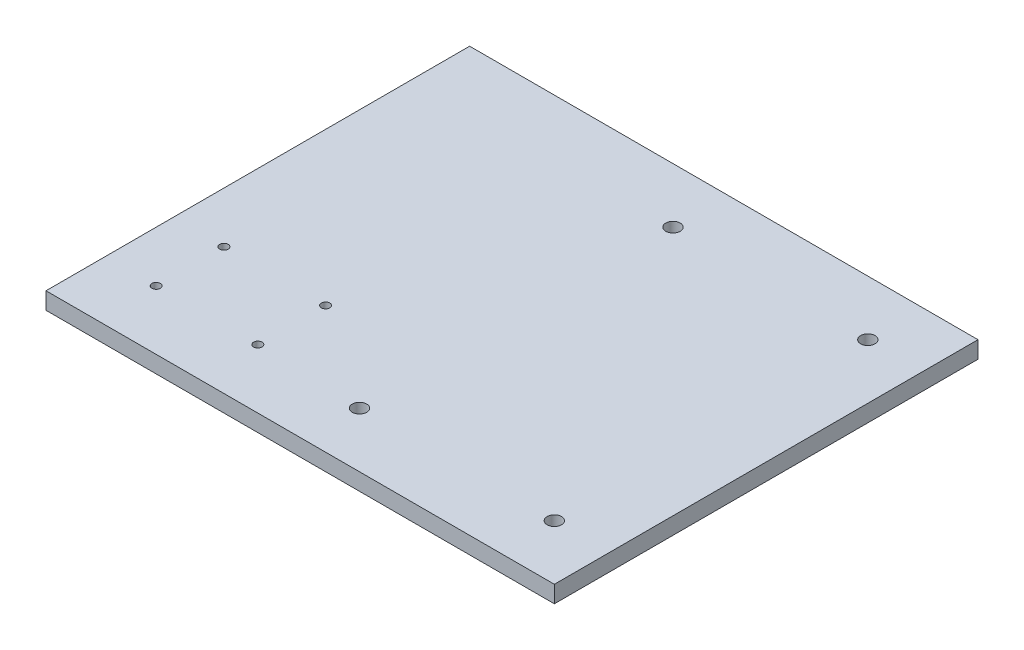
SolidWorks part; units mm, degrees
ref_plane "正面" through (0, 0, 0) normal (0, 0, 1) x (1, 0, 0)
ref_plane "平面" through (0, 0, 0) normal (0, 1, 0) x (1, 0, 0)
ref_plane "右側面" through (0, 0, 0) normal (1, 0, 0) x (0, 0, -1)
sketch "ｽｹｯﾁ1" plane through (0, 0, 0) normal (0, 1, 0) x (1, 0, 0)
  line L1 (0, 0) -> (300, 0)
  line L2 (0, 0) -> (0, 250)
  line L3 (0, 250) -> (300, 250)
  line L4 (300, 0) -> (300, 250)
  dimension "D1" = 300
  dimension "D2" = 250
extrude "押し出し1" add sketch "ｽｹｯﾁ1" along normal blind 10
hole_wizard "M6x1.0 ねじ穴2" positions "ｽｹｯﾁ7" profile "ｽｹｯﾁ6" tap size "M6x1.0" standard "JIS"
sketch "ｽｹｯﾁ7" plane through (0, 10, 0) normal (0, 1, 0) x (-1, 0, 0)
  line L1 (-30, -75) -> (-90, -75) construction
  line L2 (-30, -75) -> (-30, -35) construction
  line L3 (-30, -35) -> (-90, -35) construction
  line L4 (-90, -75) -> (-90, -35) construction
  line L6 (0, -250) -> (0, 0) construction
  line L7 (0, 0) -> (-300, 0) construction
  point P0 (-90, -75)
  point P1080 (-90, -35)
  point P1082 (-30, -35)
  point P1084 (-30, -75)
  dimension "D1" = 30
  dimension "D2" = 35
  dimension "D3" = 40
  dimension "D4" = 60
sketch "ｽｹｯﾁ6" plane through (90, 10, -75) normal (1, 0, 0) x (0, 0, 1)
  line L0 (0, 0) -> (0, 10)
  line L1 (0, 10) -> (2.5, 10)
  line L2 (2.5, 10) -> (2.5, 0)
  line L5 (2.5, 0) -> (0, 0)
  line L11 (0, -6.35) -> (0, 107.95) construction
  dimension "次ｻｰﾌｪｽまでのねじ下穴ﾄﾞﾘﾙの直径" = 5
  dimension "次ｻｰﾌｪｽまでのねじ下穴ﾄﾞﾘﾙの深さ" = 10
hole_wizard "M10x1.5 ねじ穴2" positions "ｽｹｯﾁ9" profile "ｽｹｯﾁ8" tap size "M10x1.5" standard "JIS"
sketch "ｽｹｯﾁ9" plane through (0, 10, 0) normal (0, 1, 0) x (-1, 0, 0)
  line L1 (-152.5, -217.5) -> (-267.5, -217.5) construction
  line L2 (-152.5, -217.5) -> (-152.5, -32.5) construction
  line L3 (-152.5, -32.5) -> (-267.5, -32.5) construction
  line L4 (-267.5, -217.5) -> (-267.5, -32.5) construction
  line L5 (0, -250) -> (0, 0) construction
  line L6 (0, 0) -> (-300, 0) construction
  point P97 (-267.5, -217.5)
  point P99 (-152.5, -217.5)
  point P101 (-267.5, -32.5)
  point P103 (-152.5, -32.5)
  dimension "D1" = 115
  dimension "D2" = 185
  dimension "D3" = 152.5
  dimension "D4" = 32.5
sketch "ｽｹｯﾁ8" plane through (267.5, 10, -217.5) normal (1, 0, 0) x (0, 0, 1)
  line L0 (0, 0) -> (0, 10)
  line L1 (0, 10) -> (4.25, 10)
  line L2 (4.25, 10) -> (4.25, 0)
  line L5 (4.25, 0) -> (0, 0)
  line L11 (0, -6.35) -> (0, 107.95) construction
  dimension "次ｻｰﾌｪｽまでのねじ下穴ﾄﾞﾘﾙの直径" = 8.5
  dimension "次ｻｰﾌｪｽまでのねじ下穴ﾄﾞﾘﾙの深さ" = 10
